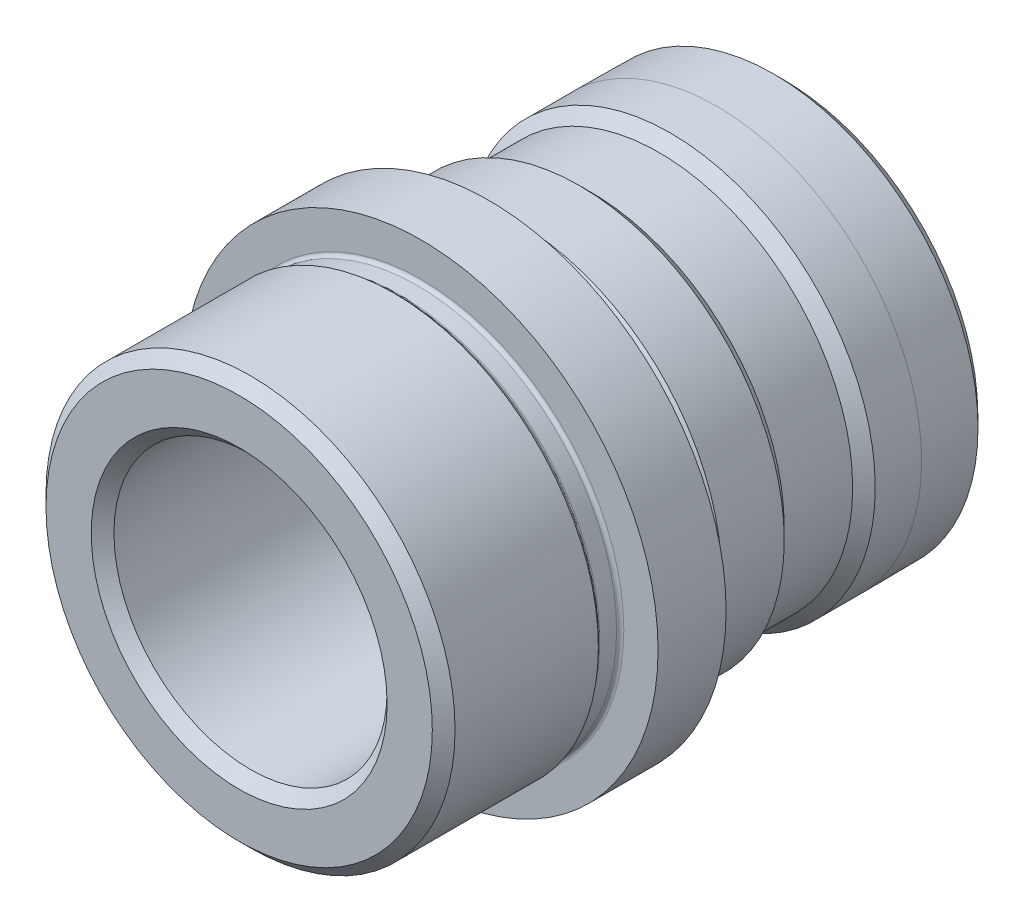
SolidWorks part; units mm, degrees
ref_plane "Front Plane" through (0, 0, 0) normal (0, 0, 1) x (1, 0, 0)
ref_plane "Top Plane" through (0, 0, 0) normal (0, 1, 0) x (1, 0, 0)
ref_plane "Right Plane" through (0, 0, 0) normal (1, 0, 0) x (0, 0, -1)
sketch "Sketch1" plane through (0, 0, 0) normal (1, 0, 0) x (0, 0, -1)
  line L0 (0, 0) -> (0, 13.8025) construction
  line L1 (0, 0) -> (-10.6147, 0) construction
  line L2 (-12.7, 9.5326) -> (25.4, 9.5326)
  line L3 (-12.7, 9.5326) -> (-12.7, 14.2748)
  line L4 (-12.7, 14.2748) -> (-1.905, 14.2748)
  line L5 (25.4, 14.2523) -> (25.4, 9.5326)
  line L6 (0, 16.5354) -> (0, 13.8938)
  line L7 (0, 16.5354) -> (4.7498, 16.5354)
  line L8 (4.7498, 16.5354) -> (4.7498, 13.8938)
  line L9 (11.8364, 13.5064) -> (16.6116, 13.5064)
  line L10 (17.399, 14.2938) -> (20.6375, 14.2938)
  line L11 (11.8364, 13.5064) -> (11.049, 14.2938)
  line L12 (16.6116, 13.5064) -> (17.399, 14.2938)
  line L13 (14.224, 13.5064) -> (14.224, 10.5708) construction
  line L14 (-1.524, 13.8938) -> (0, 13.8938)
  line L15 (6.6738, 14.2938) -> (11.049, 14.2938)
  line L16 (20.6375, 14.2938) -> (25.4, 14.2523)
  line L17 (-1.524, 13.8938) -> (-1.905, 14.2748)
  line L18 (6.2738, 13.8938) -> (6.6738, 14.2938)
  line L19 (4.7498, 13.8938) -> (6.2738, 13.8938)
  dimension "D8" = 6.35
  dimension "D1" = 28.5496
  dimension "D2" = 19.0652
  dimension "D3" = 33.0708
  dimension "D4" = 4.7498
  dimension "D5" = 25.4
  dimension "D6" = 38.1
  dimension "D7" = 0.7874
  dimension "D9" = 45
  dimension "D10" = 4.7625
  dimension "D11" = 28.5877
  dimension "D12" = 0.5
  dimension "D13" = 14.224
  dimension "D14" = 0.381
  dimension "D15" = 1.524
  dimension "D16" = 1.524
  dimension "D17" = 45
  dimension "D18" = 45
revolve "Revolve1" add sketch "Sketch1" angle 360 about L1
sketch "Sketch2" plane through (0, 0, 0) normal (0, 1, 0) x (1, 0, 0)
  line L0 (-16.5354, 0) -> (16.5354, 0) construction
  circle A0 centre (0, 14.224) radius 2.3749
  dimension "D1" = 4.7498
  dimension "D2" = 14.224
extrude "Cut-Extrude1" cut sketch "Sketch2" against normal through all
fillet "Fillet1" radius 3.048 1 edges at (-9.5326, 0, -25.4)
chamfer "Chamfer1" distance 0.7937 angle 45 3 edges at (-14.2523, 0, -25.4) (-14.2748, 0, 12.7) (-9.5326, 0, 12.7)
fillet "Fillet2" radius 0.254 4 edges at (-13.8938, 0, -6.2738) (-13.8938, 0, -4.7498) (-13.8938, 0, 1.524) (-13.8938, 0, 0)
